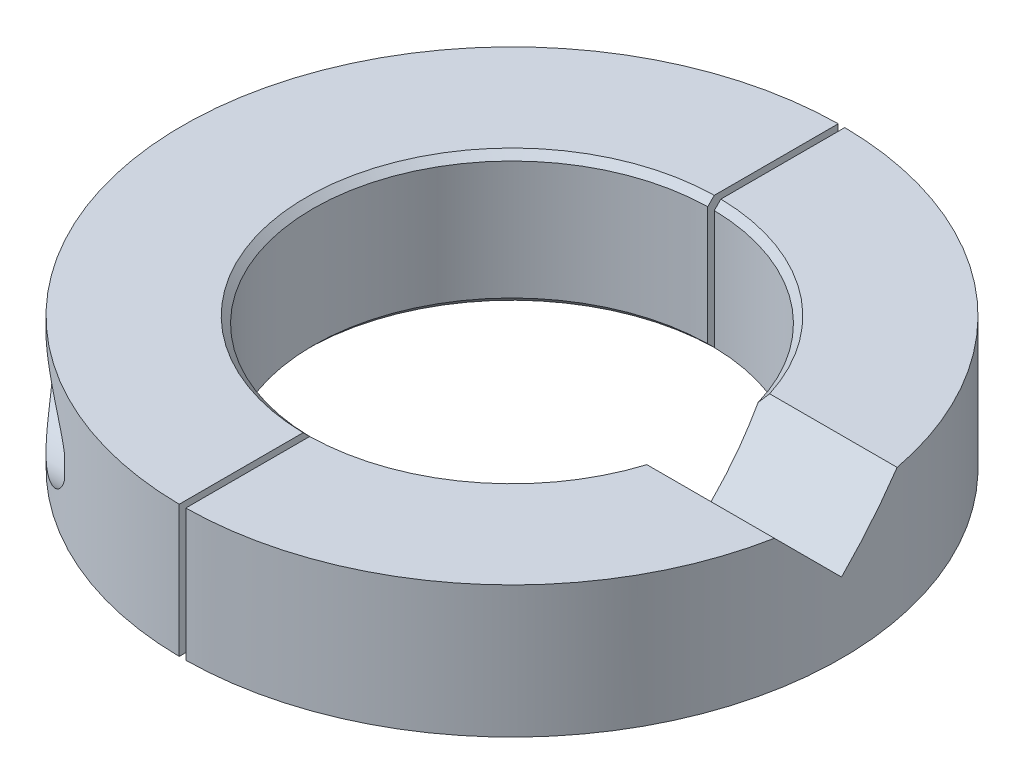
SolidWorks part; units mm, degrees
ref_plane "Plan1" through (0, 0, 0) normal (0, 0, 1) x (1, 0, 0)
ref_plane "Plan2" through (0, 0, 0) normal (0, 1, 0) x (1, 0, 0)
ref_plane "Plan3" through (0, 0, 0) normal (1, 0, 0) x (0, 0, -1)
sketch "Esquisse1" plane through (0, 0, 0) normal (0, 1, 0) x (1, 0, 0)
  circle A0 centre (0, 0) radius 15.1
  circle A1 centre (0, 0) radius 25
  dimension "D1" = 30.2
  dimension "D2" = 50
extrude "Boss.-Extru.1" add sketch "Esquisse1" along normal mid plane 10
sketch "Esquisse2" plane through (0, 0, 0) normal (1, 0, 0) x (0, 0, -1)
  line L0 (-4.6569, 5) -> (0, 0.3431)
  line L1 (0, 0.3431) -> (4.6569, 5)
  line L2 (4.6569, 5) -> (-4.6569, 5)
  line L3 (25, 5) -> (-25, 5) construction
  line L4 (0, 5.5) -> (0, -5.5) construction
  line L5 (-25, -5) -> (25, -5) construction
  circle A0 centre (0, 6) radius 4 construction
  dimension "D1" = 8
  dimension "D2" = 90
  dimension "D3" = 1
  dimension "D4" = 5.3431
extrude "Enlèv. mat.-Extru.1" cut sketch "Esquisse2" along normal through all
sketch "Esquisse3" plane through (0, 0, 0) normal (0, 1, 0) x (1, 0, 0)
  line L0 (-39.8672, 18) -> (26.8027, 18) construction
  line L1 (-32, 18) -> (-32, 14)
  line L2 (-32, 14) -> (-12, 14)
  line L3 (-12, 14) -> (-12, 15.9)
  line L4 (-12, 15.9) -> (0, 15.9)
  line L5 (0, 15.9) -> (0, 18)
  line L6 (0, 18) -> (-32, 18)
  line L7 (-5.5, 0) -> (5.5, 0) construction
  line L8 (0, -5.5) -> (0, 5.5) construction
  dimension "D1" = 18
  dimension "D2" = 4.2
  dimension "D3" = 8
  dimension "D4" = 12
  dimension "D5" = 20
revolve "Enlèvement de matière-Révolution1" cut sketch "Esquisse3" angle 360 about L0
hole_wizard "Trou taraudé M41" positions "Esquisse5" profile "Esquisse4" tap size "M4" standard "ISO"
sketch "Esquisse5" plane through (0, 0, 0) normal (-1, 0, 0) x (0, 0, 1)
  circle A0 centre (-18, 0) radius 2.1 construction
  point P0 (-18, 0)
sketch "Esquisse4" plane through (0, 0, -18) normal (0, 1, 0) x (0, 0, 1)
  line L0 (0, 0) -> (0, 12.9914)
  line L1 (0, 12.9914) -> (1.65, 12)
  line L2 (1.65, 12) -> (1.65, 0)
  line L5 (1.65, 0) -> (0, 0)
  line L10 (0, 12.9914) -> (-1.65, 12) construction
  line L11 (0, -6.35) -> (0, 107.95) construction
  dimension "Diamètre du trou pour taraudage" = 3.3
  dimension "Profondeur du trou pour taraudage" = 12
  dimension "Angle de pointe" = 118
mirror "Symétrie1" about plane through (0, 0, 0) normal (0, 0, 1) of "Trou taraudé M41", "Enlèvement de matière-Révolution1"
sketch "Esquisse6" plane through (0, 0, 0) normal (0, 1, 0) x (1, 0, 0)
  line L0 (0, 36.6435) -> (0, -36.6435)
extrude "Enlèv. de mat.-Extru.-Mince1" cut sketch "Esquisse6" against normal through all and the other way through all thin
chamfer "Chanfrein1" distance 0.5 angle 45 2 edges at (-15.1, -5, 0) (-15.1, 5, 0)
chamfer "Chanfrein2" distance 0.5 angle 45 3 edges at (15.1, -5, 0) (8.9803, 5, 12.1394) (8.9803, 5, -12.1394)
